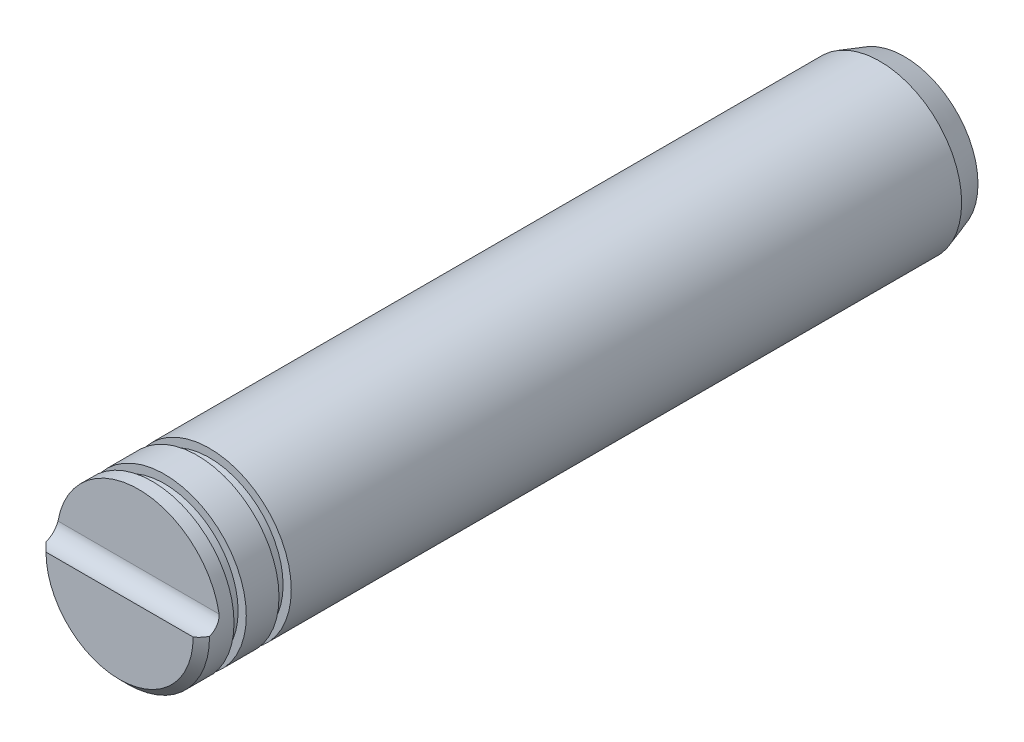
SolidWorks part; units mm, degrees
ref_plane "Face" through (0, 0, 0) normal (0, 0, 1) x (1, 0, 0)
ref_plane "Dessus" through (0, 0, 0) normal (0, 1, 0) x (1, 0, 0)
ref_plane "Droite" through (0, 0, 0) normal (1, 0, 0) x (0, 0, -1)
sketch "Esquisse1" plane through (0, 0, 0) normal (0, 0, 1) x (1, 0, 0)
  circle A0 centre (0, 0) radius 10
  dimension "D1" = 20
extrude "Base-Extrusion" add sketch "Esquisse1" along normal blind 85
chamfer "Chanfrein1" distance 1 distance2 3
sketch "Esquisse2" plane through (0, 0, 85) normal (0, 0, 1) x (1, 0, 0)
  circle A0 centre (0, 0) radius 9
  dimension "D1" = 18
extrude "Boss.-Extru.1" add sketch "Esquisse2" along normal blind 1.5
sketch "Esquisse3" plane through (0, 0, 86.5) normal (0, 0, 1) x (1, 0, 0)
  circle A0 centre (0, 0) radius 10
  dimension "D1" = 20
extrude "Boss.-Extru.2" add sketch "Esquisse3" along normal blind 4
sketch "Esquisse4" plane through (0, 0, 90.5) normal (0, 0, 1) x (1, 0, 0)
  circle A0 centre (0, 0) radius 9
  dimension "D1" = 18
extrude "Boss.-Extru.3" add sketch "Esquisse4" along normal blind 1.5
sketch "Esquisse5" plane through (0, 0, 92) normal (0, 0, 1) x (1, 0, 0)
  circle A0 centre (0, 0) radius 10
  dimension "D1" = 20
extrude "Boss.-Extru.4" add sketch "Esquisse5" along normal blind 4
chamfer "Chanfrein2" distance 1 angle 45
sketch "Esquisse6" plane through (0, 0, 0) normal (1, 0, 0) x (0, 0, -1)
  line L0 (-85, 0) -> (-3, 0) construction
  line L1 (-93.6783, 1.6971) -> (-93.6783, 13.2494)
  line L2 (-93.6783, 13.2494) -> (-101.2171, 13.2494)
  line L3 (-101.2171, 13.2494) -> (-96, 0)
  arc A0 (-96, 0) -> (-93.6783, 1.6971) centre (-95.6595, 1.9708) ccw
extrude "Enlèv. mat.-Extru.1" cut sketch "Esquisse6" along normal through all and the other way through all
